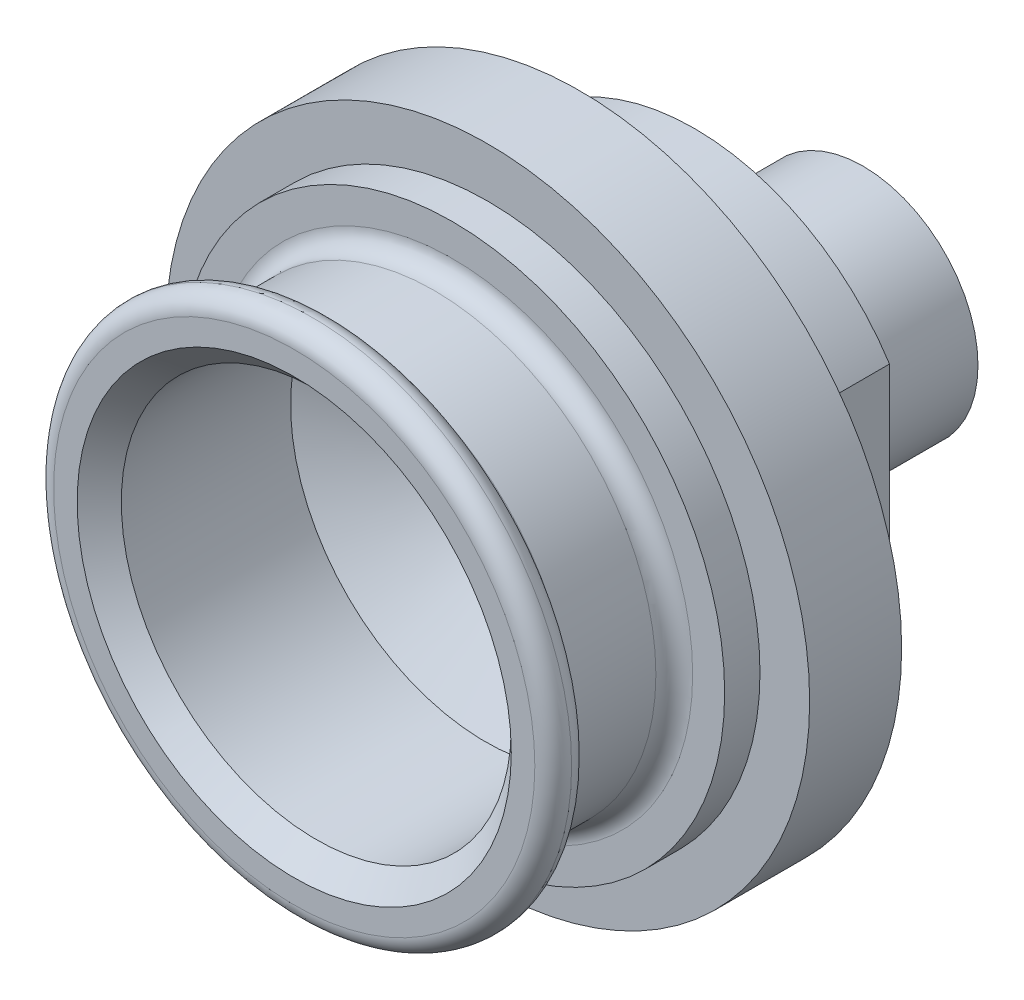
SolidWorks part; units mm, degrees
ref_plane "front" through (0, 0, 0) normal (0, 0, 1) x (1, 0, 0)
ref_plane "top" through (0, 0, 0) normal (0, 1, 0) x (1, 0, 0)
ref_plane "right" through (0, 0, 0) normal (1, 0, 0) x (0, 0, -1)
sketch "Sketch2" plane through (0, 0, 0) normal (0, 0, 1) x (1, 0, 0)
  circle A0 centre (0, 0) radius 3.9688
  dimension "D1" = 7.9375
extrude "Base-Extrude" add sketch "Sketch2" along normal blind 4.2418
sketch "Sketch3" plane through (0, 0, 4.2418) normal (0, 0, 1) x (1, 0, 0)
  circle A0 centre (0, 0) radius 3.175
  dimension "D1" = 6.35
extrude "Boss-Extrude2" add sketch "Sketch3" along normal blind 1.5748
sketch "Sketch4" plane through (0, 0, 5.8166) normal (0, 0, 1) x (1, 0, 0)
  circle A0 centre (0, 0) radius 8.001
  dimension "D1" = 16.002
extrude "Boss-Extrude3" add sketch "Sketch4" along normal blind 3.9624
sketch "Sketch12" plane through (0, 0, 9.779) normal (0, 0, 1) x (1, 0, 0)
  line L0 (-6.731, 10.16) -> (-6.731, -10.16)
  line L1 (-6.731, 10.16) -> (-10.16, 10.16)
  line L2 (-10.16, 10.16) -> (-10.16, -10.16)
  line L3 (-10.16, -10.16) -> (-6.731, -10.16)
  line L4 (0, 0) -> (0, 10.16) construction
  line L5 (10.16, -10.16) -> (6.731, -10.16)
  line L6 (6.731, 10.16) -> (6.731, -10.16)
  line L7 (6.731, 10.16) -> (10.16, 10.16)
  line L8 (10.16, 10.16) -> (10.16, -10.16)
  dimension "D1" = 6.731
extrude "Cut-Extrude2" cut sketch "Sketch12" against normal through all
sketch "Sketch13" plane through (0, 0, 9.779) normal (0, 0, 1) x (1, 0, 0)
  circle A0 centre (0, 0) radius 11.1125
  dimension "D1" = 22.225
extrude "Boss-Extrude4" add sketch "Sketch13" along normal blind 3.175
sketch "Sketch14" plane through (0, 0, 12.954) normal (0, 0, 1) x (1, 0, 0)
  circle A0 centre (0, 0) radius 9.398
  dimension "D1" = 18.796
extrude "Boss-Extrude5" add sketch "Sketch14" along normal blind 1.2192
sketch "Sketch15" plane through (0, 0, 14.1732) normal (0, 0, 1) x (1, 0, 0)
  circle A0 centre (0, 0) radius 7.6581
  dimension "D1" = 15.3162
extrude "Boss-Extrude6" add sketch "Sketch15" along normal blind 4.191
sketch "Sketch16" plane through (0, 0, 18.3642) normal (0, 0, 1) x (1, 0, 0)
  circle A0 centre (0, 0) radius 8.9408
  dimension "D1" = 17.8816
extrude "Boss-Extrude7" add sketch "Sketch16" along normal blind 1.27
hole_wizard "Hole1" positions "Sketch20" profile "Sketch19" legacy
sketch "Sketch20" plane through (0, 0, 19.6342) normal (0, 0, 1) x (1, 0, 0)
  point P0 (0, 0)
sketch "Sketch19" plane through (0, 0, 19.6342) normal (1, 0, 0) x (0, -1, 0)
  line L0 (0, 0) -> (0, 20.8857)
  line L1 (0, 20.8857) -> (2.0828, 19.6342)
  line L2 (2.0828, 19.6342) -> (2.0828, 9.3969)
  line L3 (2.0828, 9.3969) -> (6.731, 6.604)
  line L4 (6.731, 6.604) -> (6.731, 0)
  line L5 (6.731, 0) -> (0, 0)
  line L6 (0, -6.13) -> (0, 109.2824) construction
  line L7 (-2.0828, 9.3969) -> (-6.731, 6.604) construction
  line L8 (0, 20.8857) -> (-2.0828, 19.6342) construction
  dimension "Diameter" = 4.1656
  dimension "Depth" = 19.6342
  dimension "C-Drill Diameter" = 13.462
  dimension "C-Drill Depth" = 6.604
  dimension "Drill Angle" = 118
  dimension "C-Drill Angle" = 118
fillet "Fillet2" radius 0.635
fillet "Fillet3" radius 0.635
chamfer "Chamfer2" distance 0.762 angle 45
